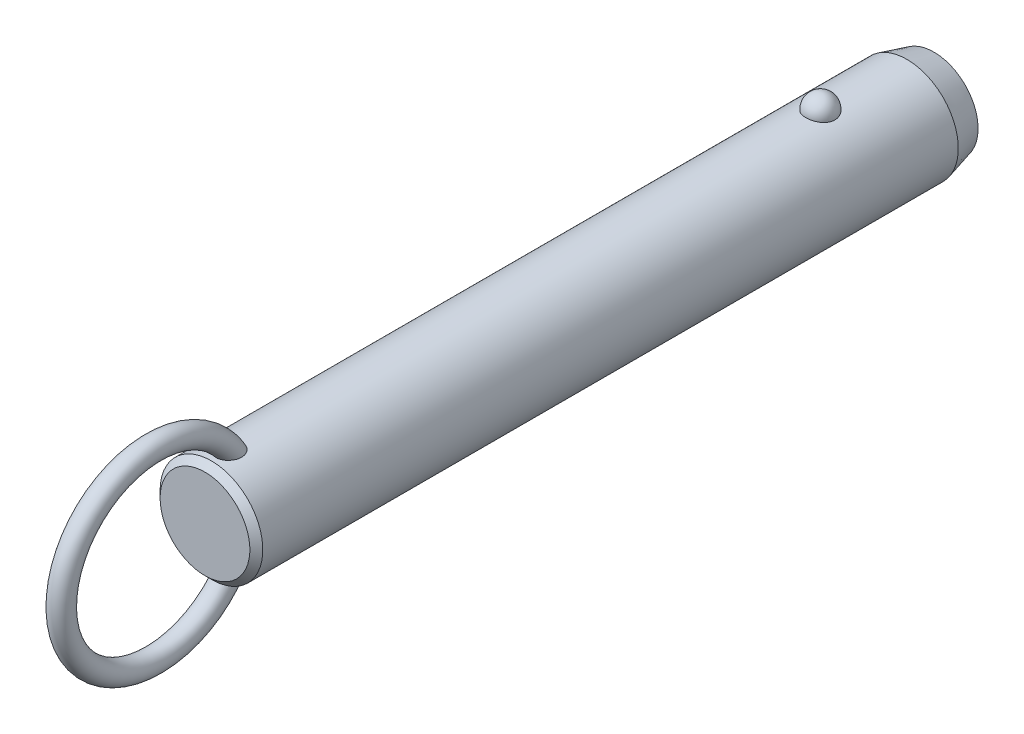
SolidWorks part; units mm, degrees
ref_plane "Front Plane" through (0, 0, 0) normal (0, 0, 1) x (1, 0, 0)
ref_plane "Top Plane" through (0, 0, 0) normal (0, 1, 0) x (1, 0, 0)
ref_plane "Right Plane" through (0, 0, 0) normal (1, 0, 0) x (0, 0, -1)
sketch "Sketch2" plane through (0, 0, 0) normal (0, 0, 1) x (1, 0, 0)
  circle A0 centre (0, 0) radius 9.5
  point P3 (0, 9.5)
  dimension "D1" = 19
extrude "Boss-Extrude1" add sketch "Sketch2" along normal blind 101.6
sketch "Sketch3" plane through (0, 0, 0) normal (0, 0, -1) x (-1, 0, 0)
  circle A0 centre (0, 0) radius 9.5
  dimension "D1" = 19
extrude "Boss-Extrude2" add sketch "Sketch3" along normal blind 23.7
chamfer "Chamfer1" distance 5 angle 15 1 edges at (-9.5, 0, -23.7)
sketch "Sketch12" plane through (0, 0, 0) normal (1, 0, 0) x (0, 0, -1)
  line L0 (-101.6, 9.5) -> (-101.6, -9.5) construction
  point P0 (-101.6, 0)
sketch "Sketch13" plane through (0, 0, 0) normal (1, 0, 0) x (0, 0, -1)
  circle A0 centre (-120.65, 0) radius 19.05
  point P2 (-101.6, 0)
  dimension "D1" = 38.1
sketch "Sketch14" plane through (0, 0, 0) normal (0, 1, 0) x (1, 0, 0)
  circle A0 centre (0, -103.6) radius 2
  point P2 (0, -101.6)
  dimension "D1" = 4
sweep "Sweep1" add profiles "Sketch14" path "Sketch13"
sketch "Sketch15" plane through (0, 0, 101.6) normal (0, 0, 1) x (1, 0, 0)
  circle A0 centre (0, 0) radius 9.5
  dimension "D1" = 19
extrude "Boss-Extrude3" add sketch "Sketch15" along normal blind 9.52
chamfer "Chamfer2" distance 1.2 angle 45 1 edges at (9.5, 0, 111.12)
sketch "Sketch18" plane through (0, 0, 0) normal (1, 0, 0) x (0, 0, -1)
  line L0 (18.7, 9.5) -> (-104.1378, 9.5) construction
  line L1 (2.7, 12.2) -> (2.7, 6.8)
  line L2 (-104.1378, -9.5) -> (18.7, -9.5) construction
  arc A0 (2.7, 12.2) -> (2.7, 6.8) centre (2.7, 9.5) ccw
  point P4 (0, 9.5)
  dimension "D1" = 21.7
revolve "Revolve1" add sketch "Sketch18" angle 360 about L1
